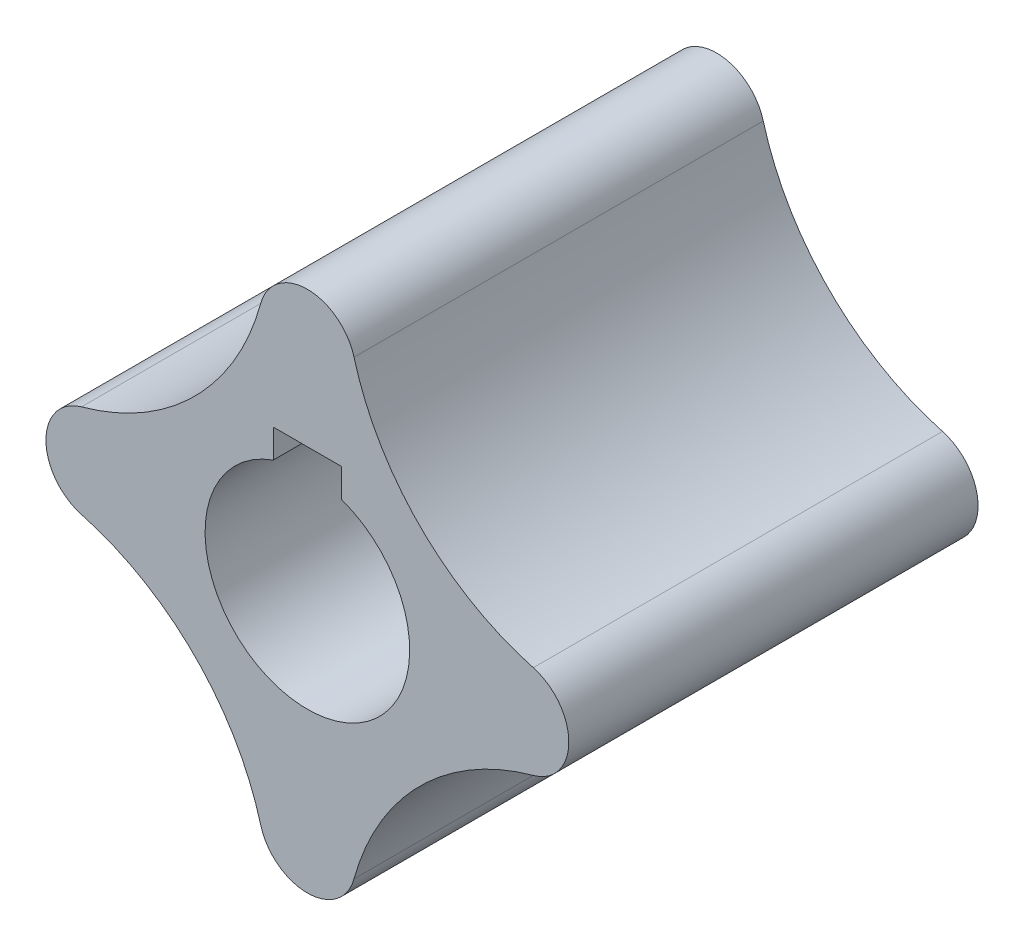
SolidWorks part; units mm, degrees
ref_plane "前视基准面" through (0, 0, 0) normal (0, 0, 1) x (1, 0, 0)
ref_plane "上视基准面" through (0, 0, 0) normal (0, 1, 0) x (1, 0, 0)
ref_plane "右视基准面" through (0, 0, 0) normal (1, 0, 0) x (0, 0, -1)
sketch "草图1" plane through (0, 0, 0) normal (0, 0, 1) x (1, 0, 0)
  line L0 (4.5, 23) -> (4.5, -27.5005) construction
  line L1 (-23.2618, 0) -> (29.3967, 0) construction
  line L3 (1.5, 8.4853) -> (1.5, 11)
  line L4 (1.5, 11) -> (7.5, 11)
  line L5 (7.5, 11) -> (7.5, 8.4853)
  arc A0 (1.5, 8.4853) -> (7.5, 8.4853) centre (4.5, 0) ccw
  circle A1 centre (4.5, 0) radius 14 construction
  arc A2 (8.6031, 19.8709) -> (0.3969, 19.8709) centre (4.5, 18.7453) ccw
  arc A3 (0.3969, 19.8709) -> (-15.3709, 4.1031) centre (-21.331, 25.831) cw
  arc A4 (-15.3709, 4.1031) -> (-15.3709, -4.1031) centre (-14.2453, 0) ccw
  arc A5 (17.1491, 6) -> (-5.298, 10) centre (4.5, 0) ccw construction
  circle A6 centre (0, 0) radius 33.5 construction
  arc A7 (8.6031, -19.8709) -> (0.3969, -19.8709) centre (4.5, -18.7453) cw
  arc A8 (0.3969, -19.8709) -> (-15.3709, -4.1031) centre (-21.331, -25.831) ccw
  arc A9 (8.6031, 19.8709) -> (24.3709, 4.1031) centre (30.331, 25.831) ccw
  arc A10 (24.3709, 4.1031) -> (24.3709, -4.1031) centre (23.2453, 0) cw
  arc A11 (8.6031, -19.8709) -> (24.3709, -4.1031) centre (30.331, -25.831) cw
  circle A12 centre (4.5, 0) radius 9 construction
  dimension "D3" = 18
  dimension "D4" = 6
  dimension "D1" = 46
  dimension "D2" = 46
  dimension "D5" = 11
extrude "拉伸1" add sketch "草图1" along normal blind 36
